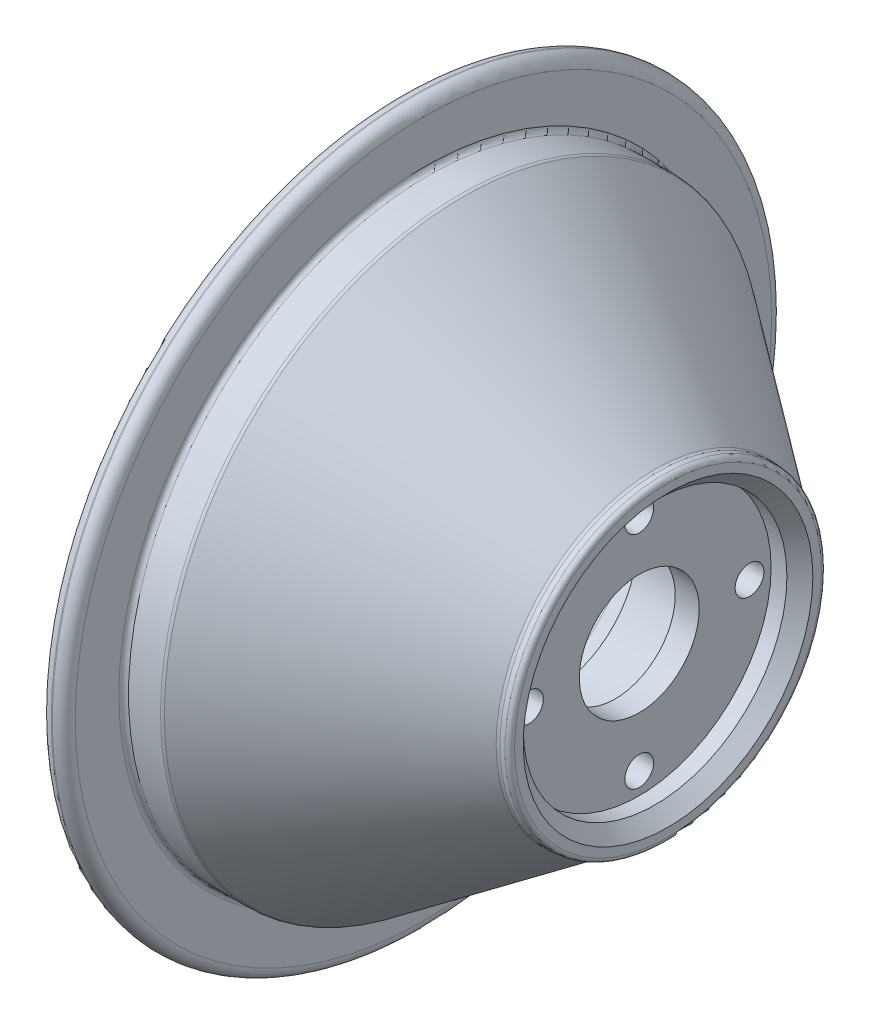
SolidWorks part; units mm, degrees
ref_plane "Face" through (0, 0, 0) normal (0, 0, 1) x (1, 0, 0)
ref_plane "Dessus" through (0, 0, 0) normal (0, 1, 0) x (1, 0, 0)
ref_plane "Droite" through (0, 0, 0) normal (1, 0, 0) x (0, 0, -1)
sketch "Esquisse1" plane through (0, 0, 0) normal (0, 0, 1) x (1, 0, 0)
  line L0 (0, 30.2) -> (0, 33)
  line L1 (0, 33) -> (-2.3967, 33)
  line L2 (-2.3967, 33) -> (-43, 62.5)
  line L3 (-43, 62.5) -> (-51, 62.5)
  line L4 (-24, 17.5) -> (-11, 17.5)
  line L5 (-51, 62.5) -> (-51, 75)
  line L6 (-51, 75) -> (-56, 75)
  line L7 (-56, 75) -> (-56, 57.5)
  line L8 (-56, 57.5) -> (-44.6246, 57.5)
  line L9 (-44.6246, 57.5) -> (-18, 38.1561)
  line L10 (-24, 17.5) -> (-24, 29.8978)
  line L11 (-11, 17.5) -> (-11, 12.5)
  line L12 (-11, 12.5) -> (-6, 12.5)
  line L13 (0, 0) -> (-113.5538, 0) construction
  line L14 (0, 30.2) -> (-2.7, 27.5)
  line L15 (-2.7, 27.5) -> (-6, 27.5)
  line L16 (-6, 27.5) -> (-6, 12.5)
  line L17 (-24, 29.8978) -> (-18, 38.1561)
  dimension "D1" = 5
  dimension "D2" = 115
  dimension "D3" = 125
  dimension "D4" = 150
  dimension "D5" = 51
  dimension "D6" = 36
  dimension "D7" = 8
  dimension "D8" = 66
  dimension "D9" = 5
  dimension "D10" = 55
  dimension "D11" = 6
  dimension "D12" = 135
  dimension "D13" = 2.7
  dimension "D14" = 35
  dimension "D15" = 90
  dimension "D16" = 24
  dimension "D17" = 5
  dimension "D18" = 25
  dimension "D19" = 6
revolve "Base-Révolution" add sketch "Esquisse1" angle 360 about L13
fillet "Congé1" radius 2.4
fillet "Congé2" radius 1
sketch "Esquisse2" plane through (-24, 0, 0) normal (-1, 0, 0) x (0, 0, 1)
  line L0 (0, 0) -> (0, 43.0668) construction
  circle A0 centre (0, 23) radius 4.5
  circle A1 centre (23, 0) radius 4.5
  circle A2 centre (0, -23) radius 4.5
  circle A3 centre (-23, 0) radius 4.5
  dimension "D1" = 9
  dimension "D2" = 23
extrude "Enlèv. mat.-Extru.4" cut sketch "Esquisse2" against normal blind 6
sketch "Esquisse3" plane through (-18, 0, 0) normal (-1, 0, 0) x (0, 0, 1)
  circle A0 centre (0, 23) radius 3
  circle A1 centre (23, 0) radius 3
  circle A2 centre (0, -23) radius 3
  circle A3 centre (-23, 0) radius 3
  dimension "D1" = 6
extrude "Enlèv. mat.-Extru.5" cut sketch "Esquisse3" against normal through all
